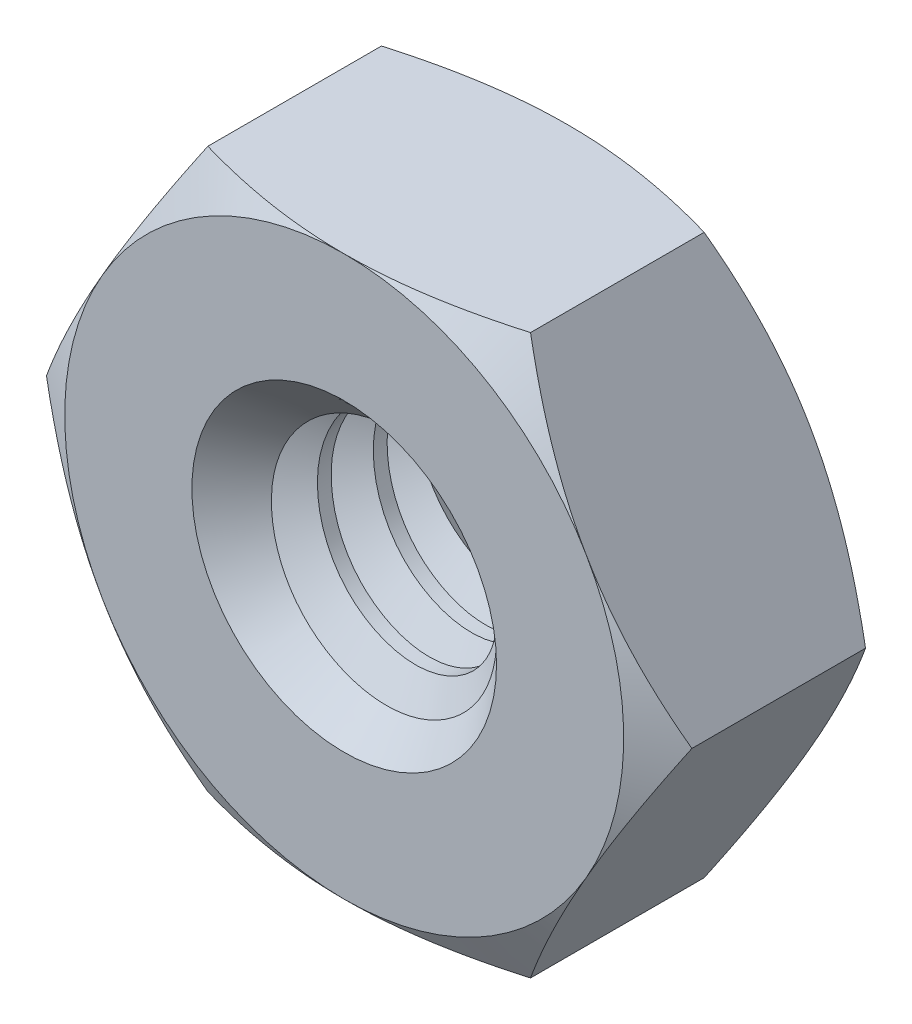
SolidWorks part; units mm, degrees
ref_plane "Front" through (0, 0, 0) normal (0, 0, 1) x (1, 0, 0)
ref_plane "Top" through (0, 0, 0) normal (0, 1, 0) x (1, 0, 0)
ref_plane "Right" through (0, 0, 0) normal (1, 0, 0) x (0, 0, -1)
sketch "Çizim1" plane through (0, 0, 0) normal (0, 0, 1) x (1, 0, 0)
  line L1 (2.3094, 0) -> (1.1547, 2)
  line L2 (1.1547, 2) -> (-1.1547, 2)
  line L3 (-1.1547, 2) -> (-2.3094, 0)
  line L4 (-2.3094, 0) -> (-1.1547, -2)
  line L5 (-1.1547, -2) -> (1.1547, -2)
  line L6 (1.1547, -2) -> (2.3094, 0)
  circle A0 centre (0, 0) radius 2 construction
  point P1 (0, 0)
  dimension "D1" = 4
extrude "Yükseklik-Ekstrüzyon1" add sketch "Çizim1" along normal blind 1.6
sketch "Çizim2" plane through (0, 0, 1.6) normal (0, 0, 1) x (1, 0, 0)
  circle A0 centre (0, 0) radius 2
extrude "Kes-Ekstrüzyon1" cut sketch "Çizim2" against normal blind 1.6 draft 60 flip side to cut
sketch "Çizim3" plane through (0, 0, 0) normal (0, 0, -1) x (-1, 0, 0)
  circle A0 centre (0, 0) radius 2
extrude "Kes-Ekstrüzyon2" cut sketch "Çizim3" against normal blind 1.6 draft 60 flip side to cut
sketch "Çizim4" plane through (0, 0, 0) normal (0, 0, -1) x (-1, 0, 0)
  circle A0 centre (0, 0) radius 0.74
  dimension "D1" = 1.48
extrude "Kes-Ekstrüzyon3" cut sketch "Çizim4" against normal blind 1.6
chamfer "Pah1" distance 0.35 angle 45 2 edges at (-0.74, 0, 1.6) (-0.74, 0, 0)
sketch "Çizim5" plane through (0, 0, 1.6) normal (0, 0, 1) x (1, 0, 0)
  circle A0 centre (0, 0) radius 0.74
curve "Helis/Spiral1"
ref_plane "Düzlem1" through (-0.74, 0, -0.4) normal (0, 0.9963, -0.0857) x (1, 0, 0)
sketch "Çizim6" plane through (-0.74, 0, -0.4) normal (0, 0.9963, -0.0857) x (1, 0, 0)
  line L0 (0.0779, 0.1951) -> (0.0779, -0.1951)
  line L1 (-0.26, 0) -> (0.0779, -0.1951)
  line L3 (0.0779, 0.1951) -> (-0.26, 0)
  line L4 (0.13, 0) -> (0.13, 0.2252)
  arc A0 (0.0779, 0.1041) -> (0.0779, -0.1041) centre (0, 0) ccw construction
  dimension "D1" = 0.26
sweep "Kes-Süpür1" cut profiles "Çizim6" path "Helis/Spiral1"
